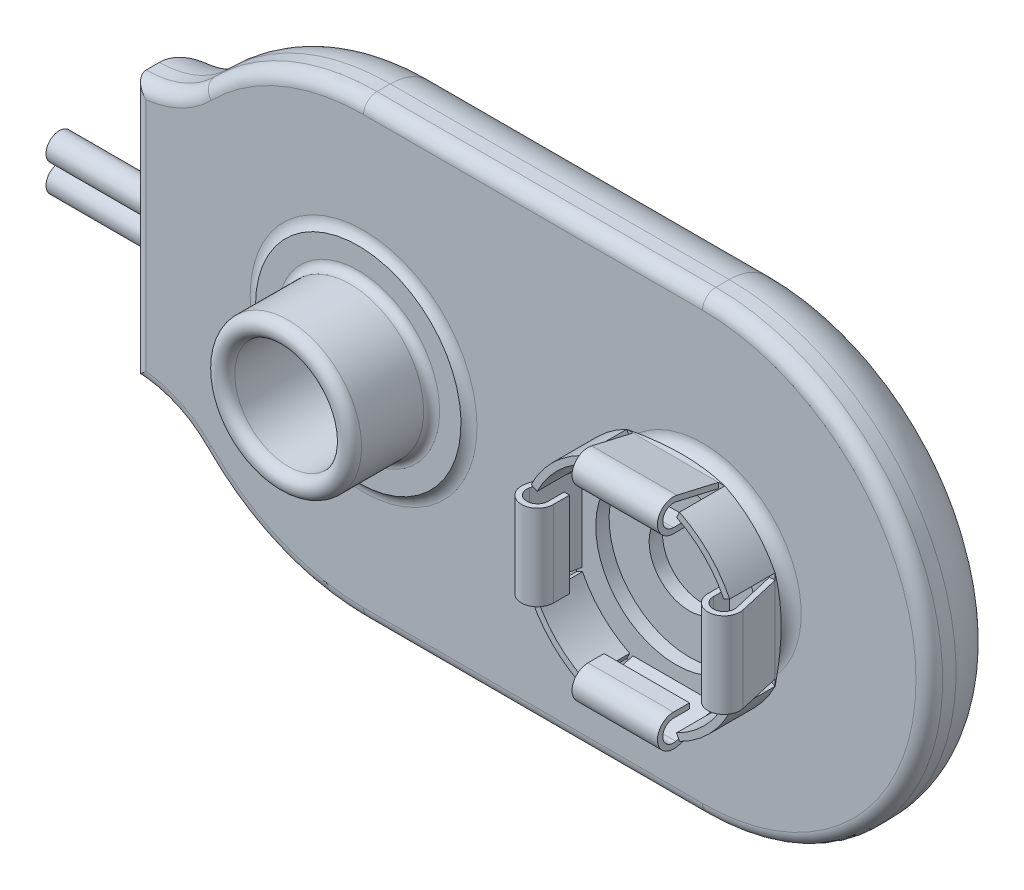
SolidWorks part; units mm, degrees
ref_plane "Front Plane" through (0, 0, 0) normal (0, 0, 1) x (1, 0, 0)
ref_plane "Top Plane" through (0, 0, 0) normal (0, 1, 0) x (1, 0, 0)
ref_plane "Right Plane" through (0, 0, 0) normal (1, 0, 0) x (0, 0, -1)
imported_body "Imported1"
sketch "Sketch1" plane through (0, 0, 44.3) normal (0, 0, 1) x (1, 0, 0)
  circle A0 centre (0, 0) radius 24.1651
extrude "Cut-Extrude1" cut sketch "Sketch1" against normal blind 100
sketch "Sketch3" plane through (0, 0, 44.3) normal (0, 0, -1) x (-1, 0, 0)
  line L1 (12.5957, -5.3656) -> (-12.536, -5.3656)
  line L2 (12.5957, -5.3656) -> (12.5957, -7.8389)
  line L3 (12.5957, -7.8389) -> (-12.536, -7.8389)
  line L4 (-12.536, -5.3656) -> (-12.536, -7.8389)
extrude "Cut-Extrude4" cut sketch "Sketch3" against normal blind 100
sketch "Sketch4" plane through (0, 0, 44.3) normal (0, 0, -1) x (-1, 0, 0)
  line L1 (10.5774, -6.0768) -> (12.0775, -6.0768)
  line L2 (10.5774, -6.0768) -> (10.5774, 7.6014)
  line L3 (10.5774, 7.6014) -> (12.0775, 7.6014)
  line L4 (12.0775, -6.0768) -> (12.0775, 7.6014)
extrude "Cut-Extrude5" cut sketch "Sketch4" against normal blind 100
sketch "Sketch5" plane through (0, 0, 44.3) normal (0, 0, -1) x (-1, 0, 0)
  line L1 (-10.656, 7.8009) -> (-12.2266, 7.8009)
  line L2 (-10.656, 7.8009) -> (-10.656, -6.2645)
  line L3 (-10.656, -6.2645) -> (-12.2266, -6.2645)
  line L4 (-12.2266, 7.8009) -> (-12.2266, -6.2645)
extrude "Cut-Extrude6" cut sketch "Sketch5" against normal blind 100
sketch "Sketch6" plane through (0, 0, 44.3) normal (0, 0, -1) x (-1, 0, 0)
  line L1 (11.4914, 7.8586) -> (-10.4175, 7.8586)
  line L2 (11.4914, 7.8586) -> (11.4914, 5.9396)
  line L3 (11.4914, 5.9396) -> (-10.4175, 5.9396)
  line L4 (-10.4175, 7.8586) -> (-10.4175, 5.9396)
extrude "Cut-Extrude7" cut sketch "Sketch6" against normal blind 10
sketch "Sketch8" plane through (0, 0, 44.3) normal (0, 0, -1) x (-1, 0, 0)
  line L1 (-10.656, 6.4) -> (-10.4175, 6.4)
  line L2 (-10.656, 6.4) -> (-10.656, 7.2718)
  line L3 (-10.656, 7.2718) -> (-10.4175, 7.2718)
  line L4 (-10.4175, 6.4) -> (-10.4175, 7.2718)
extrude "Cut-Extrude9" cut sketch "Sketch8" against normal blind 10 draft 1
sketch "Sketch9" plane through (0, 0, 44.3) normal (0, 0, -1) x (-1, 0, 0)
  line L1 (-10.3982, 7.2646) -> (-10.586, 7.2646)
  line L2 (-10.3982, 7.2646) -> (-10.3982, 6.3629)
  line L3 (-10.3982, 6.3629) -> (-10.6872, 6.3629)
  line L4 (-10.6872, 7.1259) -> (-10.6872, 6.3629)
  line L5 (-10.586, 7.3918) -> (-10.7219, 7.3918)
  line L6 (-10.586, 7.3918) -> (-10.586, 7.2646)
  line L7 (-10.6872, 7.1259) -> (-10.7219, 7.1259)
  line L8 (-10.7219, 7.3918) -> (-10.7219, 7.1259)
extrude "Cut-Extrude10" cut sketch "Sketch9" against normal blind 10
sketch "Sketch10" plane through (0, 0, 44.3) normal (0, 0, -1) x (-1, 0, 0)
  line L2 (6.35, 8.5) -> (-6.35, 8.5)
  line L3 (6.35, -8.5) -> (-6.35, -8.5)
  line L4 (15, -4.8727) -> (15, 4.8727)
  arc A0 (-6.35, 8.5) -> (-6.35, -8.5) centre (-6.35, 0) ccw
  arc A1 (6.35, -8.5) -> (12.4127, -5.9576) centre (6.35, 0) ccw
  arc A2 (12.4127, 5.9576) -> (15, 4.8727) centre (15, 8.5) ccw
  arc A3 (15, -4.8727) -> (12.4127, -5.9576) centre (15, -8.5) ccw
  arc A4 (12.4127, 5.9576) -> (6.35, 8.5) centre (6.35, 0) ccw
  point P13 (0, -8.5)
  point P14 (0, 8.5)
  point P15 (15, 0)
  point P16 (-15, 0)
extrude "Extrude1" add sketch "Sketch10" along normal blind 3
fillet "Fillet1" radius 2 8 edges at (-13.5972, 5.1549, 41.3) (-15, 0, 41.3) (-13.5972, -5.1549, 41.3) (-9.6371, -7.8387, 41.3) (0, -8.5, 41.3) (14.85, 0, 41.3) (0, 8.5, 41.3) (-9.6371, 7.8387, 41.3)
fillet "Fillet2" radius 0.5 10 edges at (0, 8.5, 44.3) (14.85, 0, 44.3) (0, -8.5, 44.3) (-9.6371, -7.8387, 44.3) (-13.5972, -5.1549, 44.3) (-15, 0, 44.3) (-13.5972, 5.1549, 44.3) (-9.6371, 7.8387, 44.3) (9.55, 0, 44.3) (-2.5, 0, 44.3)
sketch "Sketch11" plane through (-15, 0, 0) normal (-1, 0, 0) x (0, 0, 1)
  circle A0 centre (43.55, -0.5) radius 0.5
  circle A1 centre (43.55, 0.5317) radius 0.5
extrude "Extrude2" add sketch "Sketch11" along normal mid plane 7
